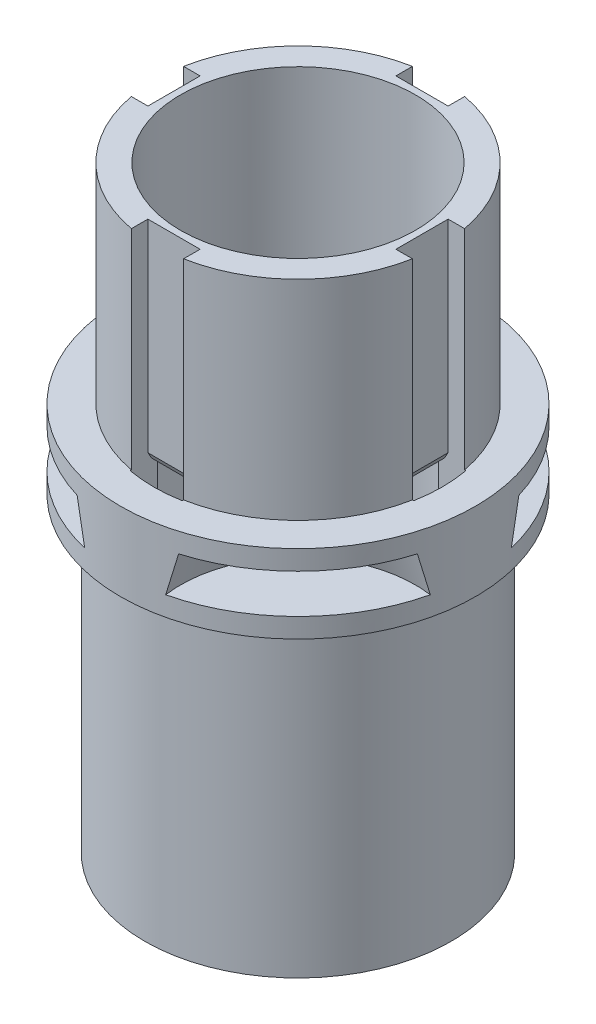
SolidWorks part; units mm, degrees
ref_plane "Front Plane" through (0, 0, 0) normal (0, 0, 1) x (1, 0, 0)
ref_plane "Top Plane" through (0, 0, 0) normal (0, 1, 0) x (1, 0, 0)
ref_plane "Right Plane" through (0, 0, 0) normal (1, 0, 0) x (0, 0, -1)
sketch "Sketch1" plane through (0, 0, 0) normal (0, 1, 0) x (1, 0, 0)
  circle A0 centre (0, 0) radius 11.74
  dimension "D1" = 23.48
extrude "Boss-Extrude1" add sketch "Sketch1" along normal blind 23.8
sketch "Sketch2" plane through (0, 23.8, 0) normal (0, 1, 0) x (1, 0, 0)
  circle A0 centre (0, 0) radius 13.6
  dimension "D1" = 27.2
extrude "Boss-Extrude2" add sketch "Sketch2" along normal blind 6
sketch "Sketch3" plane through (0, 29.8, 0) normal (0, 1, 0) x (1, 0, 0)
  circle A0 centre (0, 0) radius 10.95
  dimension "D1" = 21.9
extrude "Boss-Extrude3" add sketch "Sketch3" along normal blind 16
sketch "Sketch4" plane through (0, 45.8, 0) normal (0, 1, 0) x (1, 0, 0)
  circle A0 centre (0, 0) radius 9
  dimension "D1" = 18
extrude "Cut-Extrude1" cut sketch "Sketch4" against normal through all
ref_plane "Plane1" through (0, 25.3, 0) normal (0, -1, 0) x (-1, 0, 0)
sketch "Sketch6" plane through (0, 25.3, 0) normal (0, -1, 0) x (-1, 0, 0)
  line L0 (0, 0) -> (-16.9681, 0) construction
  line L1 (0, 0) -> (-13.8279, 13.8279) construction
  dimension "D1" = 45
sketch3d "3DSketch1"
  line L0 (13.8279, 25.3, -13.8279) -> (13.8279, 33.8174, -13.8279) construction
ref_plane "Plane2" through (0, 0, 0) normal (0.7071, 0, 0.7071) x (0.7071, 0, -0.7071)
sketch "Sketch7" plane through (0, 0, 0) normal (0.7071, 0, 0.7071) x (0.7071, 0, -0.7071)
  line L0 (8, 25.3) -> (8.8038, 28.3)
  line L1 (0, 25.3) -> (11.9983, 25.3) construction
  line L2 (8.8038, 28.3) -> (17, 28.3)
  line L3 (17, 28.3) -> (17, 25.3)
  line L4 (17, 25.3) -> (8, 25.3)
  dimension "D1" = 9
  dimension "D2" = 3
  dimension "D3" = 75
  dimension "D4" = 17
revolve "Cut-Revolve1" cut sketch "Sketch7" angle 360 about L3
pattern_circular "CirPattern1" count 4 over 360 about axis through (0, 0, 0) along (0, 1, 0) of "Cut-Revolve1"
sketch "Sketch8" plane through (0, 0, 0) normal (0, -1, 0) x (1, 0, 0)
  line L1 (2, 9.5) -> (2, 10.8675)
  line L2 (-2, 9.5) -> (-2, 10.8675)
  line L4 (-2, 9.5) -> (2, 9.5)
  circle A0 centre (0, 0) radius 11.74 construction
  circle A7 centre (0, 0) radius 11.05
  arc A8 (2, 10.8675) -> (-2, 10.8675) centre (0, 0) ccw
  point P3 (2, 0)
  point P4 (2, 13)
  point P5 (-2, 0)
  point P6 (-2, 13)
  point P9 (0, 0)
  point P13 (2.017, 11.6669)
  point P14 (-2.017, 11.6669)
  dimension "D4" = 9.5
  dimension "D6" = 0.1
extrude "Cut-Extrude3" cut sketch "Sketch8" along normal blind 17.5 from offset 45.8 contours L4 L1 A8 L2
pattern_circular "CirPattern2" count 4 over 360 about axis through (0, 0, 0) along (0, 1, 0) of "Cut-Extrude3"
sketch "Sketch9" plane through (9.5, 0, 0) normal (1, 0, 0) x (0, 0, -1)
  line L0 (-2, 28.3) -> (2, 28.3) construction
  line L1 (-2, 28.3) -> (2, 28.3)
  line L2 (-2, 29.8) -> (2, 29.8)
  line L3 (-2, 29.8) -> (-2, 28.3)
  line L4 (2, 28.3) -> (2, 29.8)
  dimension "D1" = 1.5
extrude "Cut-Extrude4" cut sketch "Sketch9" against normal blind 2
pattern_circular "CirPattern3" count 4 over 360 about axis through (0, 45.8, 0) along (0, -1, 0) of "Cut-Extrude4"
chamfer "Chamfer1" distance 1.3 angle 30 4 edges at (9, 28.3, 0) (0, 28.3, 9) (-9, 28.3, 0) (0, 28.3, -9)
chamfer "Chamfer2" distance 0.5 angle 30 4 edges at (0, 29.8, 9.5) (-9.5, 29.8, 0) (0, 29.8, -9.5) (9.5, 29.8, 0)
